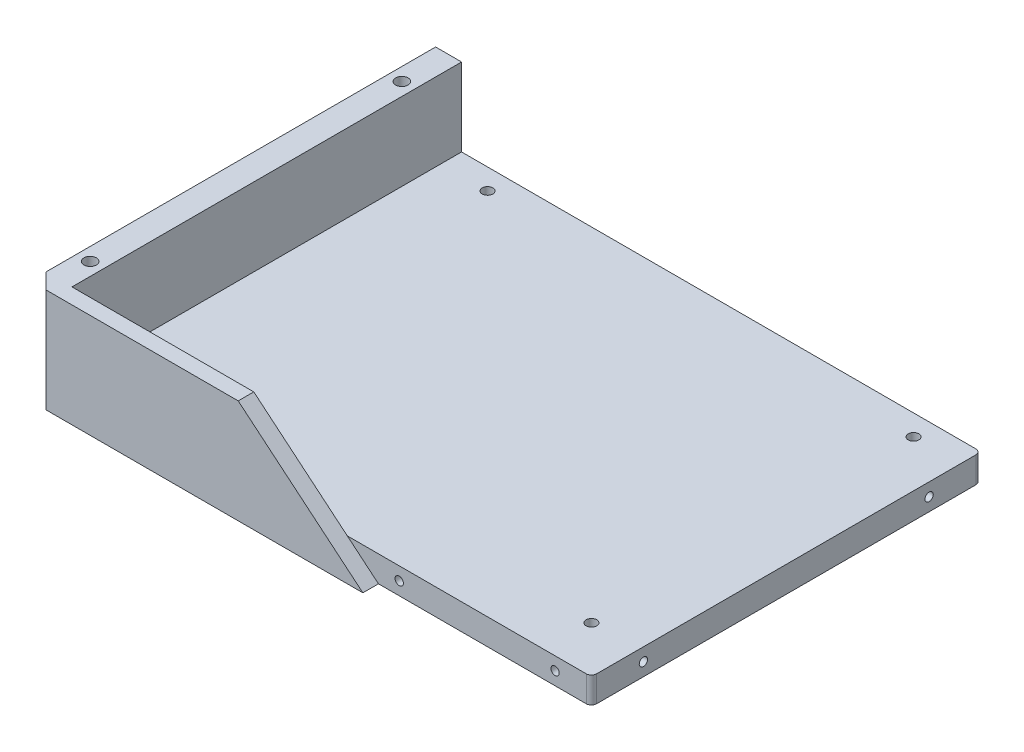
SolidWorks part; units mm, degrees
ref_plane "前视基准面" through (0, 0, 0) normal (0, 0, 1) x (1, 0, 0)
ref_plane "上视基准面" through (0, 0, 0) normal (0, 1, 0) x (1, 0, 0)
ref_plane "右视基准面" through (0, 0, 0) normal (1, 0, 0) x (0, 0, -1)
other "Configuration Table"
sketch "草图1" plane through (0, 0, 0) normal (0, 0, 1) x (1, 0, 0)
  line L0 (0, 20) -> (0, 0)
  line L1 (0, 0) -> (110, 0)
  line L2 (110, 0) -> (110, 5)
  line L3 (110, 5) -> (58, 5)
  line L5 (40, 20) -> (0, 20)
  line L6 (40, 20) -> (58, 5)
  dimension "D1" = 110
  dimension "D2" = 20
  dimension "D3" = 40
  dimension "D4" = 52
  dimension "D5" = 5
extrude "凸台-拉伸1" add sketch "草图1" along normal mid plane 96
sketch "草图2" plane through (0, 20, 0) normal (0, 1, 0) x (1, 0, 0)
  line L0 (58, -48) -> (58, 48) construction
  line L1 (111, -45) -> (5, -45)
  line L2 (111, -45) -> (111, 45)
  line L3 (111, 45) -> (5, 45)
  line L4 (5, -45) -> (5, 45)
  line L5 (111, -45) -> (5, 45) construction
  line L6 (111, 45) -> (5, -45) construction
  line L7 (0, -48) -> (0, 48) construction
  point P0 (58, 0)
  dimension "D1" = 90
  dimension "D2" = 5
extrude "切除-拉伸1" cut sketch "草图2" against normal up to surface (15 mm away)
sketch "草图3" plane through (0, 5, 0) normal (0, 1, 0) x (1, 0, 0)
  line L1 (110, 48) -> (58, 48)
  line L2 (110, 48) -> (110, 45)
  line L3 (110, 45) -> (58, 45)
  line L4 (58, 48) -> (58, 45)
  line L5 (110, -48) -> (58, -48)
  line L6 (110, -48) -> (110, -45)
  line L7 (110, -45) -> (58, -45)
  line L8 (58, -48) -> (58, -45)
extrude "切除-拉伸2" cut sketch "草图3" against normal through all
sketch "草图4" plane through (0, 5, 0) normal (0, 1, 0) x (1, 0, 0)
  line L0 (110, -45) -> (58, -45) construction
  line L1 (110, 45) -> (105, 45)
  line L2 (110, 45) -> (110, -45)
  line L3 (110, -45) -> (105, -45)
  line L4 (105, 45) -> (105, -45)
  dimension "D1" = 5
extrude "切除-拉伸3" cut sketch "草图4" against normal through all
hole_wizard "M2.5 螺纹孔1" positions "草图5" profile "草图6" tap size "M2.5" standard "GB"
sketch "草图5" plane through (0, 5, 0) normal (0, 1, 0) x (1, 0, 0)
  line L1 (14, 26) -> (96, 26)
  line L2 (14, 26) -> (14, -36)
  line L3 (14, -36) -> (96, -36)
  line L4 (96, 26) -> (96, -36)
  line L5 (0, -5) -> (105, -5) construction
  line L8 (5, 45) -> (5, -45) construction
  line L10 (58, 45) -> (105, 45) construction
  dimension "D1" = 62
  dimension "D2" = 82
  dimension "D3" = 9
  dimension "D4" = 19
sketch "草图6" plane through (14, 5, -26) normal (1, 0, 0) x (0, 0, 1)
  line L0 (0, 0) -> (0, 6.9659)
  line L1 (0, 6.9659) -> (1.025, 6.35)
  line L2 (1.025, 6.35) -> (1.025, 0)
  line L5 (1.025, 0) -> (0, 0)
  line L10 (0, 6.9659) -> (-1.025, 6.35) construction
  line L11 (0, -6.35) -> (0, 107.95) construction
  dimension "螺纹孔钻头直径" = 2.05
  dimension "螺纹孔钻头深度" = 6.35
  dimension "导头角度" = 118
sketch "草图7" plane through (0, 20, 0) normal (0, 1, 0) x (1, 0, 0)
  line L0 (0, -48) -> (0, 48) construction
  line L1 (58, 48) -> (0, 48)
  line L2 (58, 48) -> (58, 45)
  line L3 (58, 45) -> (0, 45)
  line L5 (0, 48) -> (0, 45)
extrude "切除-拉伸4" cut sketch "草图7" against normal through all
chamfer "倒角1" distance 3 angle 45 1 edges at (0, 10, 48)
sketch "草图9" plane through (0, 20, 0) normal (0, 1, 0) x (1, 0, 0)
  line L0 (105, 45) -> (105, -45) construction
  line L1 (0, 45) -> (105, 45)
  line L2 (0, 45) -> (0, 30)
  line L3 (0, 30) -> (105, 30)
  line L4 (105, 45) -> (105, 30)
  dimension "D1" = 15
extrude "切除-拉伸5" cut sketch "草图9" against normal through all
fillet "圆角1" radius 1 2 edges at (105, 2.5, 45) (105, 2.5, -30)
sketch "草图10" plane through (0, 0, -30) normal (0, 0, -1) x (-1, 0, 0)
  point P0 (-89, 2.5)
  point P3 (-19, 2.5)
hole_wizard "M2 螺纹孔1" positions "草图10" profile "草图11" tap size "M2" standard "GB"
sketch "草图11" plane through (89, 2.5, -30) normal (1, 0, 0) x (0, 1, 0)
  line L0 (0, 0) -> (0, 5.6807)
  line L1 (0, 5.6807) -> (0.8, 5.2)
  line L2 (0.8, 5.2) -> (0.8, 0)
  line L5 (0.8, 0) -> (0, 0)
  line L10 (0, 5.6807) -> (-0.8, 5.2) construction
  line L11 (0, -6.35) -> (0, 107.95) construction
  dimension "螺纹孔钻头直径" = 1.6
  dimension "螺纹孔钻头深度" = 5.2
  dimension "导头角度" = 118
hole_wizard "M2 螺纹孔2" positions "草图13" profile "草图14" tap size "M2" standard "GB"
sketch "草图13" plane through (105, 0, 0) normal (1, 0, 0) x (0, 0, -1)
  point P0 (-35, 2.5)
  point P3 (20, 2.5)
sketch "草图14" plane through (105, 2.5, 35) normal (0, 1, 0) x (0, 0, -1)
  line L0 (0, 0) -> (0, 5.6807)
  line L1 (0, 5.6807) -> (0.8, 5.2)
  line L2 (0.8, 5.2) -> (0.8, 0)
  line L5 (0.8, 0) -> (0, 0)
  line L10 (0, 5.6807) -> (-0.8, 5.2) construction
  line L11 (0, -6.35) -> (0, 107.95) construction
  dimension "螺纹孔钻头直径" = 1.6
  dimension "螺纹孔钻头深度" = 5.2
  dimension "导头角度" = 118
hole_wizard "M2 螺纹孔3" positions "草图15" profile "草图16" tap size "M2" standard "GB"
sketch "草图15" plane through (0, 0, 45) normal (0, 0, 1) x (1, 0, 0)
  point P0 (68, 2.5)
  point P3 (98, 2.5)
sketch "草图16" plane through (68, 2.5, 45) normal (1, 0, 0) x (0, -1, 0)
  line L0 (0, 0) -> (0, 5.6807)
  line L1 (0, 5.6807) -> (0.8, 5.2)
  line L2 (0.8, 5.2) -> (0.8, 0)
  line L5 (0.8, 0) -> (0, 0)
  line L10 (0, 5.6807) -> (-0.8, 5.2) construction
  line L11 (0, -6.35) -> (0, 107.95) construction
  dimension "螺纹孔钻头直径" = 1.6
  dimension "螺纹孔钻头深度" = 5.2
  dimension "导头角度" = 118
hole_wizard "M2 六角圆柱头螺钉的柱形沉头孔1" positions "草图18" profile "草图19" counterbore size "M2" standard "GB"
sketch "草图18" plane through (0, 0, 0) normal (0, -1, 0) x (-1, 0, 0)
  line L0 (0, -45) -> (0, 30) construction
  line L2 (0, 30) -> (-104, 30) construction
  point P0 (-2.5, 21)
  point P2 (-2.5, -39)
  dimension "D1" = 2.5
  dimension "D2" = 60
  dimension "D3" = 9
sketch "草图19" plane through (2.5, 0, -21) normal (1, 0, 0) x (0, 0, -1)
  line L0 (0, 0) -> (0, 20)
  line L1 (0, 20) -> (1.2, 20)
  line L3 (1.2, 20) -> (1.2, 18)
  line L4 (1.2, 18) -> (2.15, 18)
  line L5 (2.15, 18) -> (2.15, 0)
  line L7 (2.15, 0) -> (0, 0)
  line L11 (0, -6.35) -> (0, 107.95) construction
  dimension "通孔孔直径" = 2.4
  dimension "通孔孔深度" = 20
  dimension "柱形沉头孔直径" = 4.3
  dimension "柱形沉头孔深度" = 18
sketch "草图20" plane through (0, 0, 45) normal (0, 0, 1) x (1, 0, 0)
  line L0 (58, 5) -> (64, 0)
  line L1 (104, 0) -> (58, 0) construction
  line L2 (40, 20) -> (64, 0) construction
  line L3 (64, 0) -> (58, 0)
  line L4 (58, 0) -> (58, 5)
extrude "凸台-拉伸2" add sketch "草图20" along normal up to surface (3 mm away)
sketch "草图21" plane through (0, 0, 0) normal (0, -1, 0) x (1, 0, 0)
  line L0 (3, 48) -> (64, 48) construction
  line L1 (20, 33) -> (88, 33) construction
  line L2 (20, 33) -> (20, -18) construction
  line L3 (20, -18) -> (88, -18) construction
  line L4 (88, 33) -> (88, -18) construction
  line L5 (3, -33) -> (105, -33) construction
  line L6 (0, 45) -> (0, -30) construction
  line L7 (108, 45) -> (108, -30) construction
  circle A0 centre (20, 33) radius 4.05
  circle A1 centre (88, 33) radius 4.05
  circle A2 centre (88, -18) radius 4.05
  circle A3 centre (20, -18) radius 4.05
  dimension "D1" = 8.1
  dimension "D4" = 20
  dimension "D5" = 20
  dimension "D2" = 15
  dimension "D3" = 15
extrude "切除-拉伸6" cut sketch "草图21" against normal blind 1
sketch "草图22" plane through (0, 0, 0) normal (-1, 0, 0) x (0, 0, 1)
  line L1 (-28, 0) -> (43, 0)
  line L2 (-28, 0) -> (-28, 6.6)
  line L3 (-28, 6.6) -> (43, 6.6)
  line L4 (43, 0) -> (43, 6.6)
  line L5 (-30, 0) -> (-30, 20) construction
  line L6 (45, 0) -> (-30, 0) construction
  line L7 (45, 0) -> (45, 20) construction
  dimension "D1" = 6.6
  dimension "D2" = 2
  dimension "D3" = 2
extrude "凸台-拉伸3" add sketch "草图22" along normal blind 2
sketch "草图23" plane through (0, 0, 43) normal (0, 0, 1) x (1, 0, 0)
  line L0 (-2, 6.6) -> (0, 4.6)
  line L2 (0, 4.6) -> (0, 6.6)
  line L3 (0, 6.6) -> (-2, 6.6)
  dimension "D1" = 45
extrude "切除-拉伸7" cut sketch "草图23" against normal through all
fillet "圆角2" radius 0.1 1 edges at (0, 4.6, 7.5)
chamfer "倒角2" distance 0.3 angle 45 4 edges at (-2, 6.6, 7.5) (-2, 3.3, 43) (-2, 0, 7.5) (-2, 3.3, -28)
